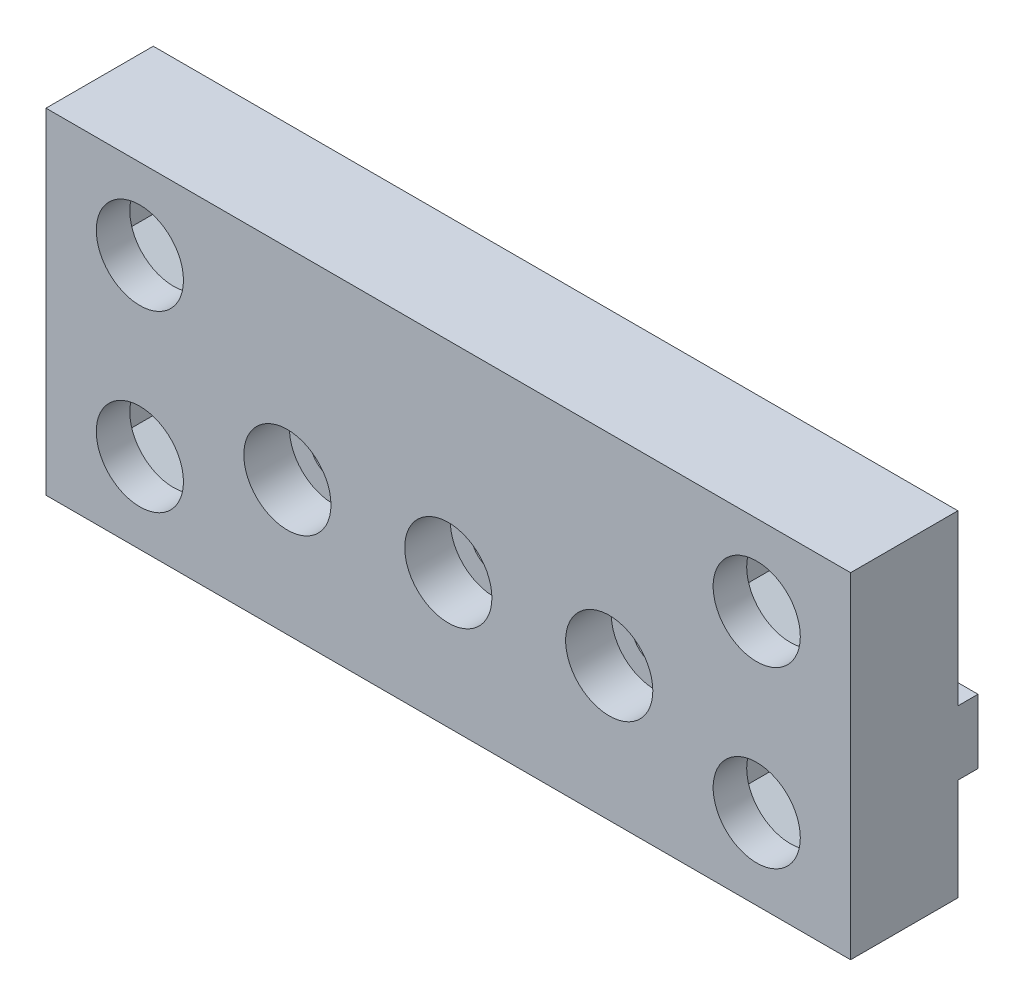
SolidWorks part; units mm, degrees
ref_plane "Ebene vorne" through (0, 0, 0) normal (0, 0, 1) x (1, 0, 0)
ref_plane "Ebene oben" through (0, 0, 0) normal (0, 1, 0) x (1, 0, 0)
ref_plane "Ebene rechts" through (0, 0, 0) normal (1, 0, 0) x (0, 0, -1)
sketch "Skizze1" plane through (0, 0, 0) normal (0, 0, 1) x (1, 0, 0)
  line L1 (-30, -12.5) -> (30, -12.5)
  line L2 (-30, -12.5) -> (-30, 12.5)
  line L3 (-30, 12.5) -> (30, 12.5)
  line L4 (30, -12.5) -> (30, 12.5)
  line L5 (-30, -12.5) -> (30, 12.5) construction
  line L6 (-30, 12.5) -> (30, -12.5) construction
  point P0 (0, 0)
  dimension "D1" = 25
  dimension "D2" = 60
extrude "Aufsatz-Linear austragen1" add sketch "Skizze1" along normal mid plane 8
sketch "Skizze4" plane through (0, 0, -4) normal (0, 0, -1) x (-1, 0, 0)
  line L0 (30, 12.5) -> (30, -12.5) construction
  line L1 (-30, -4.9) -> (30, -4.9)
  line L2 (-30, -4.9) -> (-30, -0.1)
  line L3 (-30, -0.1) -> (30, -0.1)
  line L4 (30, -4.9) -> (30, -0.1)
  line L5 (-30, 12.5) -> (30, 12.5) construction
  line L7 (-30, -12.5) -> (-30, 12.5) construction
  point P0 (0, 0)
  point P10 (-30, 0)
  point P11 (-30, 4.9)
  dimension "D1" = 4.8
  dimension "D2" = 12.6
extrude "Aufsatz-Linear austragen2" add sketch "Skizze4" along normal mid plane 3
hole_wizard "Ø6.5 (6.5) Durchmesser Bohrung1" positions "Skizze2" profile "Skizze3" hole size "Ø6.5" standard "DIN"
sketch "Skizze2" plane through (0, 0, 4) normal (0, 0, 1) x (1, 0, 0)
  point P0 (-23, 6.5)
  point P2 (23, 6.5)
  point P9 (-23, -6.5)
  point P11 (23, -6.5)
  dimension "D1" = 23
  dimension "D2" = 6.5
  dimension "D3" = 6.5
  dimension "D4" = 23
sketch "Skizze3" plane through (-23, 6.5, 4) normal (1, 0, 0) x (0, -1, 0)
  line L0 (0, 0) -> (0, 9.5)
  line L1 (0, 9.5) -> (3.25, 9.5)
  line L2 (3.25, 9.5) -> (3.25, 0)
  line L5 (3.25, 0) -> (0, 0)
  line L11 (0, -6.35) -> (0, 107.95) construction
  dimension "Bohrerdurchmesser" = 6.5
  dimension "Bohrungstiefe" = 9.5
sketch "Skizze5" plane through (0, 0, -4) normal (0, 0, -1) x (-1, 0, 0)
  line L1 (-23, 12.389) -> (-28.1, 9.4445)
  line L2 (-28.1, 9.4445) -> (-28.1, 3.5555)
  line L3 (-28.1, 3.5555) -> (-23, 0.611)
  line L4 (-23, 0.611) -> (-17.9, 3.5555)
  line L5 (-17.9, 3.5555) -> (-17.9, 9.4445)
  line L6 (-17.9, 9.4445) -> (-23, 12.389)
  line L7 (23, 12.389) -> (17.9, 9.4445)
  line L8 (17.9, 9.4445) -> (17.9, 3.5555)
  line L9 (17.9, 3.5555) -> (23, 0.611)
  line L10 (23, 0.611) -> (28.1, 3.5555)
  line L11 (28.1, 3.5555) -> (28.1, 9.4445)
  line L12 (28.1, 9.4445) -> (23, 12.389)
  line L13 (-23, -0.611) -> (-28.1, -3.5555)
  line L14 (-28.1, -3.5555) -> (-28.1, -9.4445)
  line L15 (-28.1, -9.4445) -> (-23, -12.389)
  line L16 (-23, -12.389) -> (-17.9, -9.4445)
  line L17 (-17.9, -9.4445) -> (-17.9, -3.5555)
  line L18 (-17.9, -3.5555) -> (-23, -0.611)
  line L19 (23, -0.611) -> (17.9, -3.5555)
  line L20 (17.9, -3.5555) -> (17.9, -9.4445)
  line L21 (17.9, -9.4445) -> (23, -12.389)
  line L22 (23, -12.389) -> (28.1, -9.4445)
  line L23 (28.1, -9.4445) -> (28.1, -3.5555)
  line L24 (28.1, -3.5555) -> (23, -0.611)
  circle A0 centre (-23, 6.5) radius 5.1 construction
  circle A1 centre (23, 6.5) radius 5.1 construction
  circle A2 centre (-23, -6.5) radius 5.1 construction
  circle A3 centre (23, -6.5) radius 5.1 construction
  dimension "D1" = 10.2
extrude "Schnitt-Linear austragen1" cut sketch "Skizze5" against normal blind 5.5 and the other way through all
hole_wizard "Stirnsenkung für M3 Zylinderschraube mit Innensechskant1" positions "Skizze6" profile "Skizze7" counterbore size "M3" standard "DIN"
sketch "Skizze6" plane through (0, 0, 4) normal (0, 0, 1) x (1, 0, 0)
  point P0 (-12, -2.5)
  point P2 (0, -2.5)
  point P5 (12, -2.5)
  point P6 (0, 0)
  point P7 (0.2826, 3.1239)
  point P9 (0, 0)
  point P10 (0, -1.7215)
  dimension "D1" = 12
  dimension "D2" = 12
  dimension "D3" = 2.5
sketch "Skizze7" plane through (-12, -2.5, 4) normal (1, 0, 0) x (0, -1, 0)
  line L0 (0, 0) -> (0, 9.5)
  line L1 (0, 9.5) -> (1.7, 9.5)
  line L3 (1.7, 9.5) -> (1.7, 3.4)
  line L4 (1.7, 3.4) -> (3.25, 3.4)
  line L5 (3.25, 3.4) -> (3.25, 0)
  line L7 (3.25, 0) -> (0, 0)
  line L11 (0, -6.35) -> (0, 107.95) construction
  dimension "Bohrerdurchmesser" = 3.4
  dimension "Bohrungstiefe" = 9.5
  dimension "Senkdurchmesser2" = 6.5
  dimension "Senktiefe2" = 3.4
